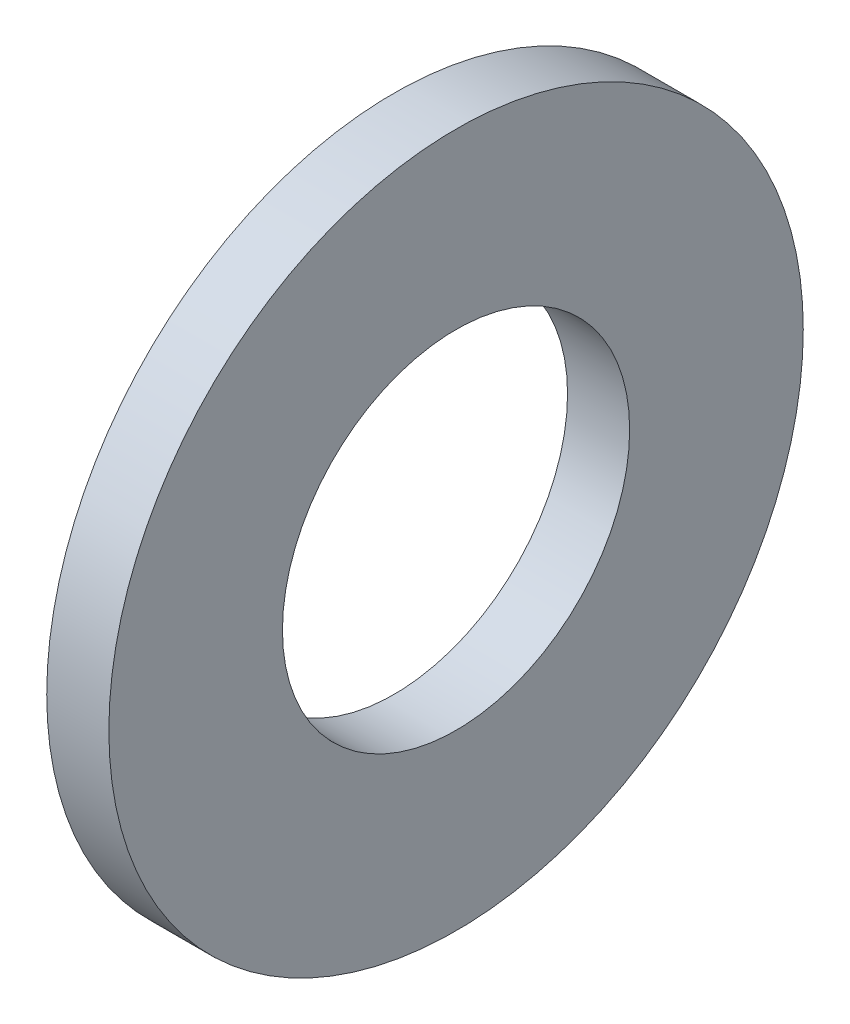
SolidWorks part; units mm, degrees
ref_plane "Plane1" through (0, 0, 0) normal (0, 0, 1) x (1, 0, 0)
ref_plane "Plane2" through (0, 0, 0) normal (0, 1, 0) x (1, 0, 0)
ref_plane "Plane3" through (0, 0, 0) normal (1, 0, 0) x (0, 0, -1)
revolve "Base-Revolve" add sketch "Sketch1" angle 360 about L0
sketch "Sketch1" plane through (0, 0, 0) normal (0, 0, 1) x (1, 0, 0)
  line L0 (-34.925, 0) -> (9.525, 0) construction
  line L1 (0, 6.7437) -> (0, 13.4874)
  line L2 (0, 13.4874) -> (-2.413, 13.4874)
  line L3 (-2.413, 13.4874) -> (-2.413, 6.7437)
  line L4 (-2.413, 6.7437) -> (0, 6.7437)
  dimension "Thickness" = 2.413
  dimension "Inside_dia" = 13.4874
  dimension "Outside_dia" = 26.9748
